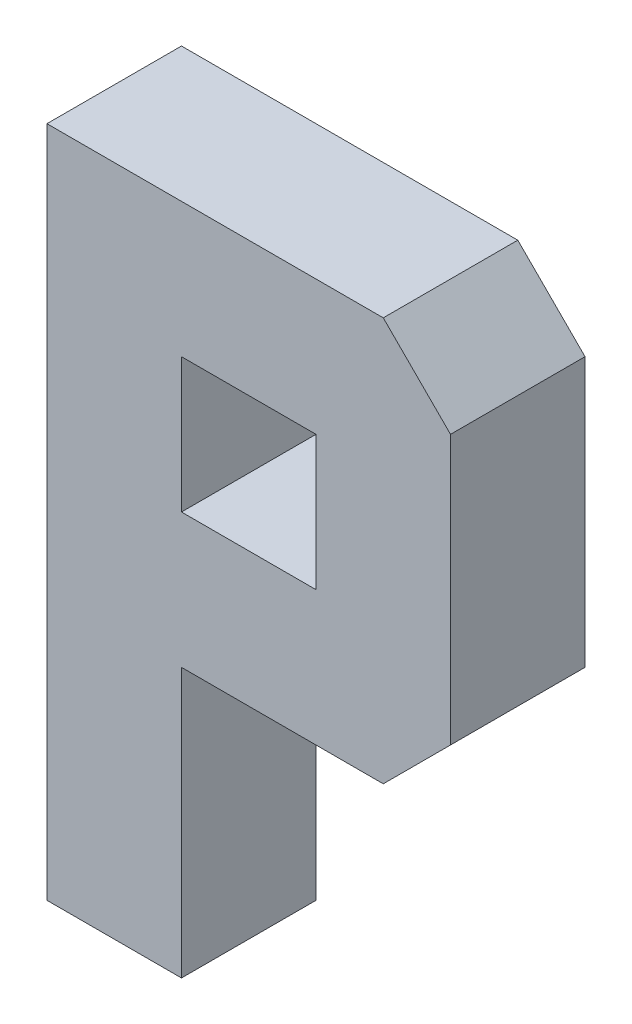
SolidWorks part; units mm, degrees
ref_plane "Plan de face" through (0, 0, 0) normal (0, 0, 1) x (1, 0, 0)
ref_plane "Plan de dessus" through (0, 0, 0) normal (0, 1, 0) x (1, 0, 0)
ref_plane "Plan de droite" through (0, 0, 0) normal (1, 0, 0) x (0, 0, -1)
sketch "Esquisse1" plane through (0, 0, 0) normal (0, 0, 1) x (1, 0, 0)
  line L1 (0, 0) -> (10, 0)
  line L2 (0, 0) -> (0, 50)
  line L3 (0, 50) -> (10, 50)
  line L4 (10, 0) -> (10, 20)
  line L5 (10, 50) -> (30, 50)
  line L6 (10, 40) -> (20, 40)
  line L7 (10, 20) -> (30, 20)
  line L8 (30, 50) -> (30, 20)
  line L9 (10, 40) -> (10, 30)
  line L10 (10, 30) -> (20, 30)
  line L11 (20, 40) -> (20, 30)
  dimension "D1" = 10
  dimension "D2" = 50
  dimension "D3" = 30
  dimension "D4" = 20
  dimension "D5" = 10
  dimension "D6" = 10
  dimension "D7" = 10
  dimension "D8" = 10
extrude "Boss.-Extru.1" add sketch "Esquisse1" along normal blind 10
chamfer "Chanfrein1" distance 5 angle 45 2 edges at (30, 20, 5) (30, 50, 5)
